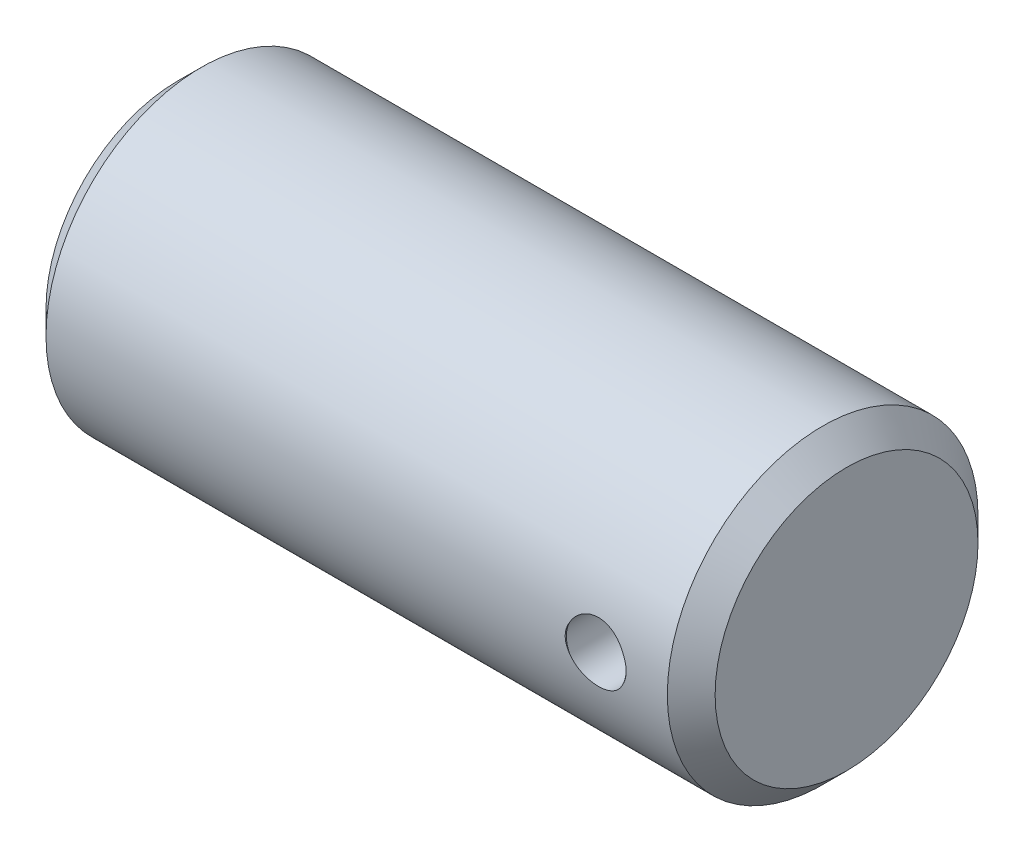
SolidWorks part; units mm, degrees
ref_plane "前视基准面" through (0, 0, 0) normal (0, 0, 1) x (1, 0, 0)
ref_plane "上视基准面" through (0, 0, 0) normal (0, 1, 0) x (1, 0, 0)
ref_plane "右视基准面" through (0, 0, 0) normal (1, 0, 0) x (0, 0, -1)
other "Configuration Table"
sketch "草图1" plane through (0, 0, 0) normal (0, 0, 1) x (1, 0, 0)
  line L0 (0, 0) -> (29.289, 0) construction
  line L1 (24, 6.5) -> (24, 0) construction
  line L2 (0, 0) -> (28, 0)
  line L3 (0, 0) -> (0, 6.5)
  line L4 (0, 6.5) -> (28, 6.5)
  line L5 (28, 0) -> (28, 6.5)
  dimension "D1" = 6.5
  dimension "D2" = 28
  dimension "D3" = 4
revolve "旋转1" add sketch "草图1" angle 360 about L2
chamfer "倒角1" distance 1 2 edges at (28, 0, 6.5) (0, 0, 6.5)
ref_plane "基准面1" through (24, 0, 0) normal (1, 0, 0) x (0, 0, -1)
ref_plane "基准面2" through (0, 0, 6.5) normal (0, 0, 1) x (1, 0, 0)
sketch3d "3D草图4"
  line L0 (24, 6.0955, 0) -> (24, -5.4481, 0) construction
  circle A0 centre (28, 0, 0) radius 5.5 construction
  point P4 (33.5, 0, 0)
  dimension "D1" = 4
sketch "草图15" plane through (0, 0, 6.5) normal (0, 0, 1) x (1, 0, 0)
  line L0 (24, 6.0955) -> (24, -5.9747) construction
  line L1 (24, -6.05) -> (24, 6.05) construction
  point P7 (24, 0)
hole_wizard "Ø2.5mm 暗销孔3" positions "草图15" profile "草图16" hole size "Ø2.5" standard "GB"
sketch "草图16" plane through (24, 0, 6.5) normal (1, 0, 0) x (0, -1, 0)
  line L0 (0, 0) -> (0, 3.7511)
  line L1 (0, 3.7511) -> (1.25, 3)
  line L2 (1.25, 3) -> (1.25, 0.025)
  line L3 (1.25, 0.025) -> (1.275, 0)
  line L5 (1.275, 0) -> (0, 0)
  line L6 (-1.25, 0.025) -> (-1.275, 0) construction
  line L10 (0, 3.7511) -> (-1.25, 3) construction
  line L11 (0, -6.35) -> (0, 107.95) construction
  dimension "孔直径" = 2.5
  dimension "孔深度" = 3
  dimension "近端锥形沉头孔直径" = 2.55
  dimension "近端锥形沉头孔角度" = 90
  dimension "导头角度" = 118
